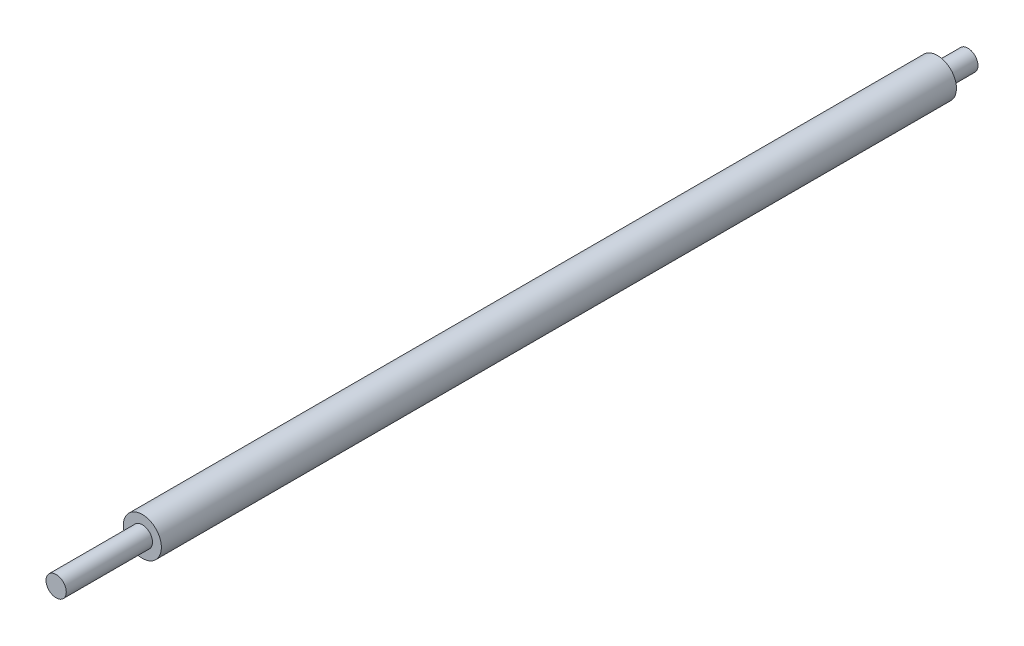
SolidWorks part; units mm, degrees
ref_plane "Alzado" through (0, 0, 0) normal (0, 0, 1) x (1, 0, 0)
ref_plane "Planta" through (0, 0, 0) normal (0, 1, 0) x (1, 0, 0)
ref_plane "Vista lateral" through (0, 0, 0) normal (1, 0, 0) x (0, 0, -1)
sketch "Croquis1" plane through (0, 0, 0) normal (0, 0, 1) x (1, 0, 0)
  circle A0 centre (0, 0) radius 7.5
extrude "Extruir2" add sketch "Croquis1" along normal blind 313.5
sketch "Croquis3" plane through (0, 0, 313.5) normal (0, 0, 1) x (1, 0, 0)
  circle A0 centre (0, 0) radius 4
extrude "Extruir3" add sketch "Croquis3" along normal blind 34
sketch "Croquis4" plane through (0, 0, 0) normal (0, 0, -1) x (-1, 0, 0)
  circle A0 centre (0, 0) radius 4
extrude "Extruir4" add sketch "Croquis4" along normal blind 12
